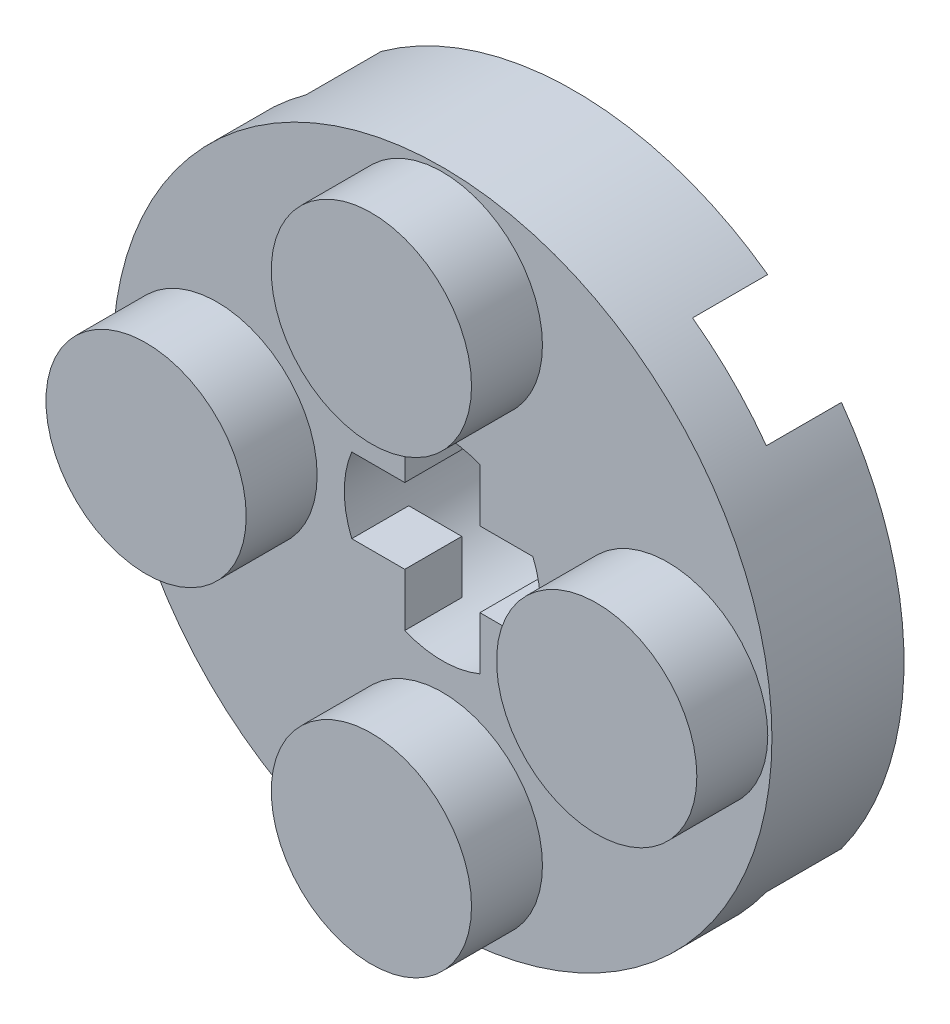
SolidWorks part; units mm, degrees
ref_plane "Alzado" through (0, 0, 0) normal (0, 0, 1) x (1, 0, 0)
ref_plane "Planta" through (0, 0, 0) normal (0, 1, 0) x (1, 0, 0)
ref_plane "Vista lateral" through (0, 0, 0) normal (1, 0, 0) x (0, 0, -1)
sketch "Croquis1" plane through (0, 0, 0) normal (0, 0, 1) x (1, 0, 0)
  circle A0 centre (0, 0) radius 7.9
  dimension "D1" = 15.8
extrude "Extruir1" add sketch "Croquis1" along normal blind 3.166
sketch "Croquis2" plane through (0, 0, 3.166) normal (0, 0, 1) x (1, 0, 0)
  circle A0 centre (0, 5.4) radius 2.4
  circle A1 centre (5.4, 0) radius 2.4
  circle A2 centre (0, -5.4) radius 2.4
  circle A3 centre (-5.4, 0) radius 2.4
  dimension "D1" = 4.8
  dimension "D2" = 5.4
  dimension "D3" = 5.4
  dimension "D4" = 5.4
  dimension "D5" = 5.4
extrude "Extruir2" add sketch "Croquis2" along normal blind 1.7
sketch "Sketch1" plane through (0, 0, 0) normal (0, 0, -1) x (-1, 0, 0)
  line L1 (6.4, -6.4) -> (-6.4, -6.4)
  line L2 (6.4, -6.4) -> (6.4, 6.4)
  line L3 (6.4, 6.4) -> (-6.4, 6.4)
  line L4 (-6.4, -6.4) -> (-6.4, 6.4)
  line L5 (6.4, -6.4) -> (-6.4, 6.4) construction
  line L6 (6.4, 6.4) -> (-6.4, -6.4) construction
  point P0 (0, 0)
  dimension "D1" = 12.8
  dimension "D2" = 12.8
extrude "Cut-Extrude2" cut sketch "Sketch1" against normal blind 1.8
sketch "Sketch2" plane through (0, 0, 3.166) normal (0, 0, 1) x (1, 0, 0)
  line L0 (-5.5857, 0) -> (5.5757, 0) construction
  line L1 (0, 3.4877) -> (0, 3.3313) construction
  line L2 (0, -5.1286) -> (0, 3.9427) construction
  line L3 (-2.1708, 0.9) -> (-0.9, 0.9)
  line L4 (-2.1708, -0.9) -> (-0.9, -0.9)
  line L5 (-0.9, 2.1708) -> (-0.9, 0.9)
  line L6 (0.9, 2.1708) -> (0.9, 0.9)
  line L7 (-0.9, -0.9) -> (-0.9, -2.1708)
  line L8 (0.9, -0.9) -> (0.9, -2.1708)
  line L9 (0.9, 0.9) -> (2.1708, 0.9)
  line L10 (0.9, -0.9) -> (2.1708, -0.9)
  arc A0 (-2.1708, 0.9) -> (-2.1708, -0.9) centre (0, 0) ccw
  arc A1 (0.9, 2.1708) -> (-0.9, 2.1708) centre (0, 0) ccw
  arc A2 (2.1708, -0.9) -> (2.1708, 0.9) centre (0, 0) ccw
  arc A3 (-0.9, -2.1708) -> (0.9, -2.1708) centre (0, 0) ccw
  dimension "D1" = 4.7
  dimension "D2" = 0.9
  dimension "D3" = 1.8
  dimension "D4" = 0.9
  dimension "D5" = 1.8
extrude "Cut-Extrude3" cut sketch "Sketch2" against normal through all
sketch "Sketch3" plane through (0, 0, 1.8) normal (0, 0, -1) x (-1, 0, 0)
  line L0 (-4.6314, 6.4) -> (4.6314, 6.4) construction
  circle A0 centre (0, 0) radius 2.35
  circle A1 centre (0, 0) radius 3
  point P3 (0, 6.4)
  dimension "D1" = 4.7
  dimension "D2" = 6
extrude "Boss-Extrude1" add sketch "Sketch3" along normal blind 1.8
